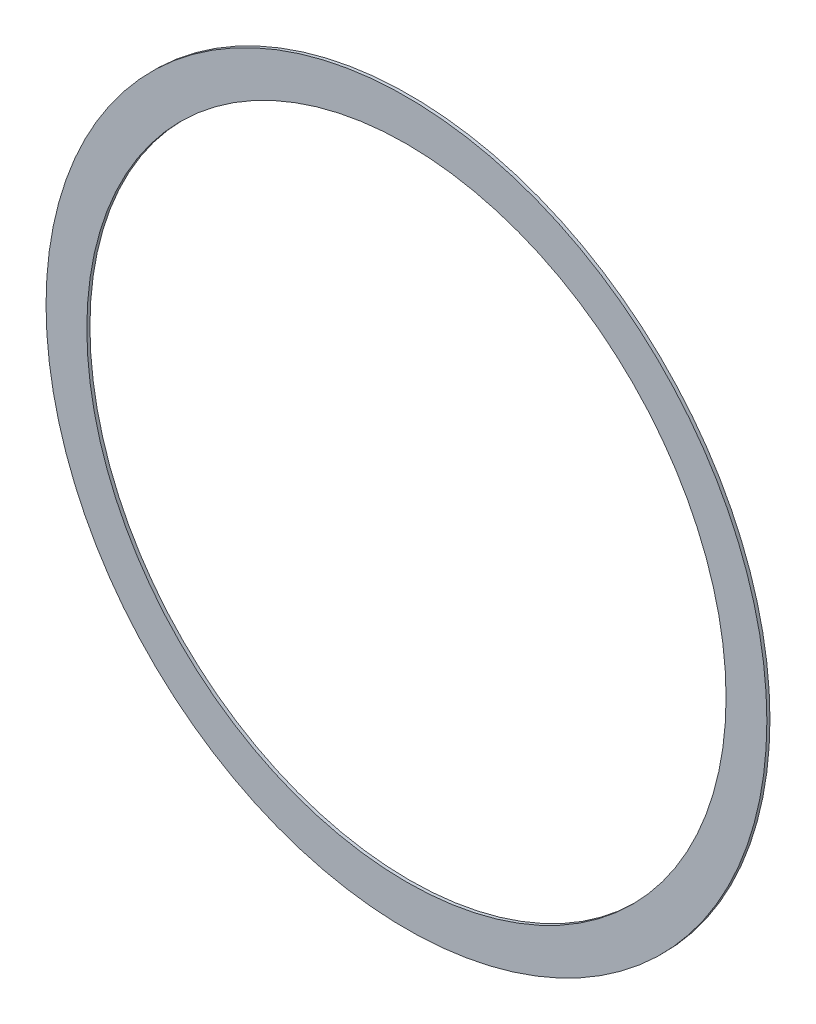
SolidWorks part; units mm, degrees
ref_plane "Plan de face" through (0, 0, 0) normal (0, 0, 1) x (1, 0, 0)
ref_plane "Plan de dessus" through (0, 0, 0) normal (0, 1, 0) x (1, 0, 0)
ref_plane "Plan de droite" through (0, 0, 0) normal (1, 0, 0) x (0, 0, -1)
sketch "Esquisse1" plane through (0, 0, 0) normal (0, 0, 1) x (1, 0, 0)
  circle A0 centre (0, 0) radius 309.5
  circle A1 centre (0, 0) radius 349
  dimension "D1" = 698
  dimension "D2" = 619
extrude "Extrusion1" add sketch "Esquisse1" along normal blind 3
